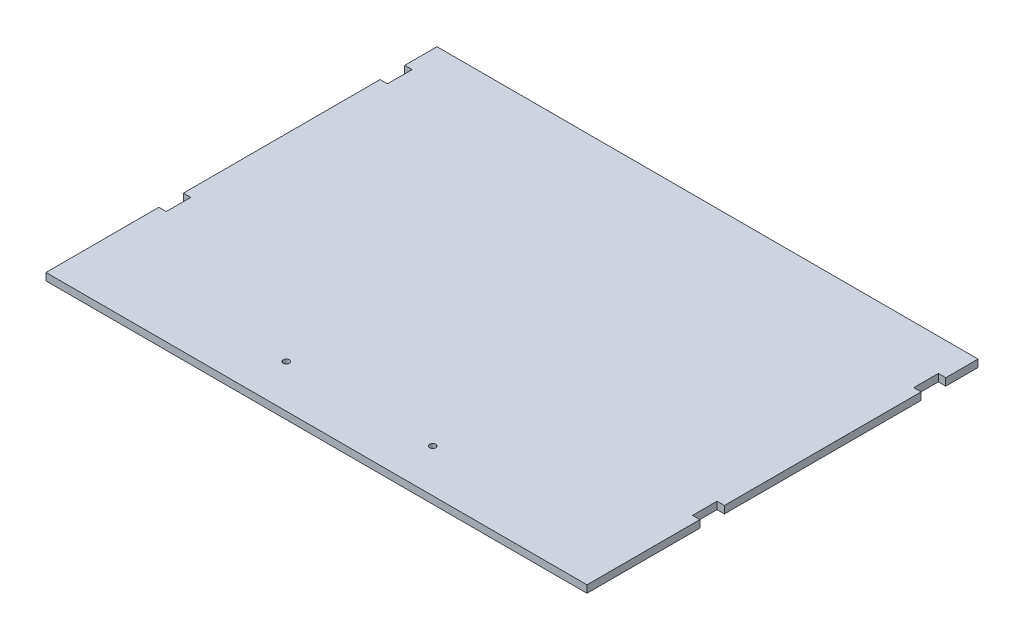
SolidWorks part; units mm, degrees
ref_plane "Ebene vorne" through (0, 0, 0) normal (0, 0, 1) x (1, 0, 0)
ref_plane "Ebene oben" through (0, 0, 0) normal (0, 1, 0) x (1, 0, 0)
ref_plane "Ebene rechts" through (0, 0, 0) normal (1, 0, 0) x (0, 0, -1)
sketch "Skizze1" plane through (0, 0, 0) normal (0, 1, 0) x (1, 0, 0)
  line L0 (0, 81.3117) -> (0, -166.2985) construction
  line L1 (-100.5013, 0) -> (107.6567, 0) construction
  line L2 (-220, 112.75) -> (-220, -47.25)
  line L3 (-220, 159) -> (220, 159)
  line L4 (-220, 159) -> (-220, 132.75)
  line L5 (-220, -159) -> (220, -159)
  line L6 (220, 159) -> (220, 132.75)
  line L7 (-220, 132.75) -> (-214, 132.75)
  line L8 (-220, -67.25) -> (-220, -159)
  line L9 (-220, 112.75) -> (-214, 112.75)
  line L10 (-214, 132.75) -> (-214, 112.75)
  line L11 (-220, -47.25) -> (-214, -47.25)
  line L12 (214, -47.25) -> (214, -67.25)
  line L13 (-220, -67.25) -> (-214, -67.25)
  line L14 (-214, -47.25) -> (-214, -67.25)
  line L15 (220, -67.25) -> (214, -67.25)
  line L16 (220, -47.25) -> (214, -47.25)
  line L17 (214, 132.75) -> (214, 112.75)
  line L18 (220, 112.75) -> (214, 112.75)
  line L19 (220, 132.75) -> (214, 132.75)
  line L21 (220, 112.75) -> (220, -47.25)
  line L22 (220, -67.25) -> (220, -159)
  circle A0 centre (-59.5, -124) radius 2.5
  circle A1 centre (59.5, -124) radius 2.5
  dimension "D8" = 5
  dimension "D1" = 440
  dimension "D2" = 318
  dimension "D3" = 26.25
  dimension "D4" = 6
  dimension "D5" = 20
  dimension "D6" = 20
  dimension "D7" = 160
  dimension "D9" = 119
  dimension "D10" = 35
extrude "Aufsatz-Linear austragen1" add sketch "Skizze1" along normal blind 6
